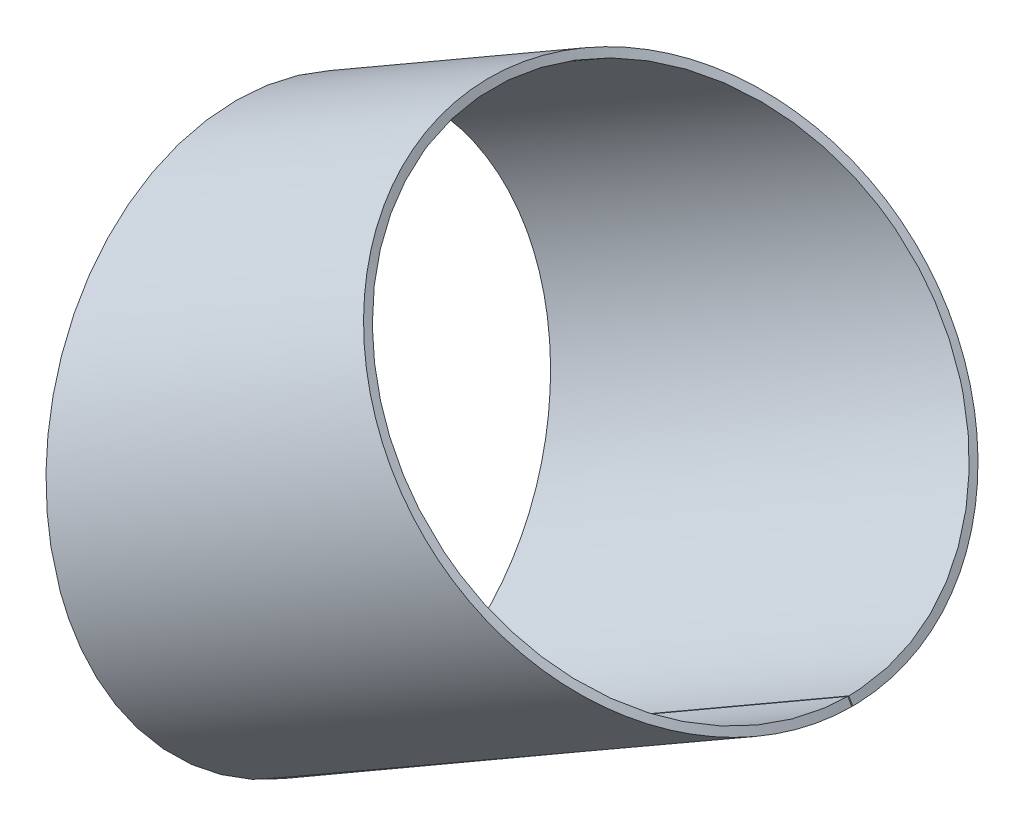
SolidWorks part; units mm, degrees
ref_plane "前视基准面" through (0, 0, 0) normal (0, 0, 1) x (1, 0, 0)
ref_plane "上视基准面" through (0, 0, 0) normal (0, 1, 0) x (1, 0, 0)
ref_plane "右视基准面" through (0, 0, 0) normal (1, 0, 0) x (0, 0, -1)
imported_body "基体零件-人字形三通管-1"
sheet metal parameters "钣金1" parameters "D1"=0.7366, "厚度"=8
bend "圆角折弯1" bend radius 242 bend angle 359.771 parameters "D5"=1
flatten bends "展开-折弯1"
sketch "尖角-草图1" plane through (-275.0003, -909.3262, -0.5) normal (0.5, -0.866, -0.002) x (0.866, 0.5, 0.0012)
  line L0 (280.469, -760.1058) -> (-282.2236, -759.456) construction
  dimension "D1" = 0
process bends "加工-折弯1" parameters "D1"=0
sketch "平面-草图1" plane through (-275.0003, -909.3262, -0.5) normal (0.5, -0.866, -0.002) x (0.866, 0.5, 0.0012)
